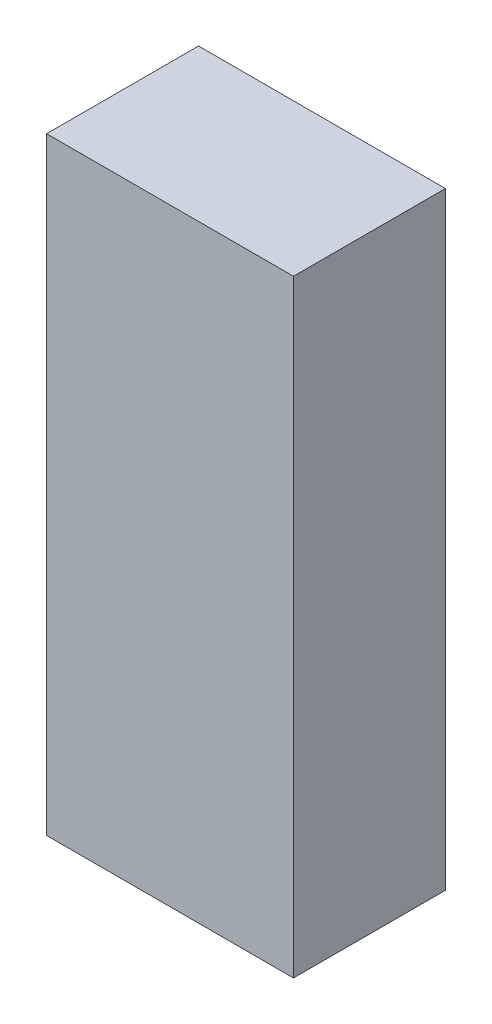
SolidWorks part; units mm, degrees
ref_plane "Front Plane" through (0, 0, 0) normal (0, 0, 1) x (1, 0, 0)
ref_plane "Top Plane" through (0, 0, 0) normal (0, 1, 0) x (1, 0, 0)
ref_plane "Right Plane" through (0, 0, 0) normal (1, 0, 0) x (0, 0, -1)
sketch "Sketch1" plane through (0, 0, 0) normal (0, 1, 0) x (1, 0, 0)
  line L1 (-41.275, 25.4) -> (41.275, 25.4)
  line L2 (-41.275, 25.4) -> (-41.275, -25.4)
  line L3 (-41.275, -25.4) -> (41.275, -25.4)
  line L4 (41.275, 25.4) -> (41.275, -25.4)
  line L5 (-41.275, 25.4) -> (41.275, -25.4) construction
  line L6 (-41.275, -25.4) -> (41.275, 25.4) construction
  point P0 (0, 0)
  dimension "D1" = 82.55
  dimension "D2" = 50.8
extrude "Boss-Extrude1" add sketch "Sketch1" along normal blind 457.2
sketch "Sketch2" plane through (0, 0, -25.4) normal (0, 0, -1) x (-1, 0, 0)
  line L0 (41.275, 457.2) -> (41.275, 254) construction
  line L1 (41.275, 457.2) -> (41.275, 0) construction
  line L3 (41.275, 254) -> (-41.275, 254)
  line L4 (41.275, 254) -> (41.275, 0)
  line L5 (41.275, 0) -> (-41.275, 0)
  line L6 (-41.275, 254) -> (-41.275, 0)
  dimension "D1" = 203.2
extrude "Cut-Extrude1" cut sketch "Sketch2" against normal through all
sketch "Sketch3" [suppressed] plane through (0, 0, 0) normal (0, -1, 0) x (-1, 0, 0)
  line L0 (44.45, -19.05) -> (37.7319, 19.05)
  line L1 (-44.45, 19.05) -> (44.45, 19.05) construction
  line L2 (37.7319, 19.05) -> (44.45, 19.05)
  line L3 (44.45, 19.05) -> (44.45, -19.05)
  dimension "D1" = 10
extrude "Cut-Extrude2" [suppressed] cut sketch "Sketch3" against normal through all
